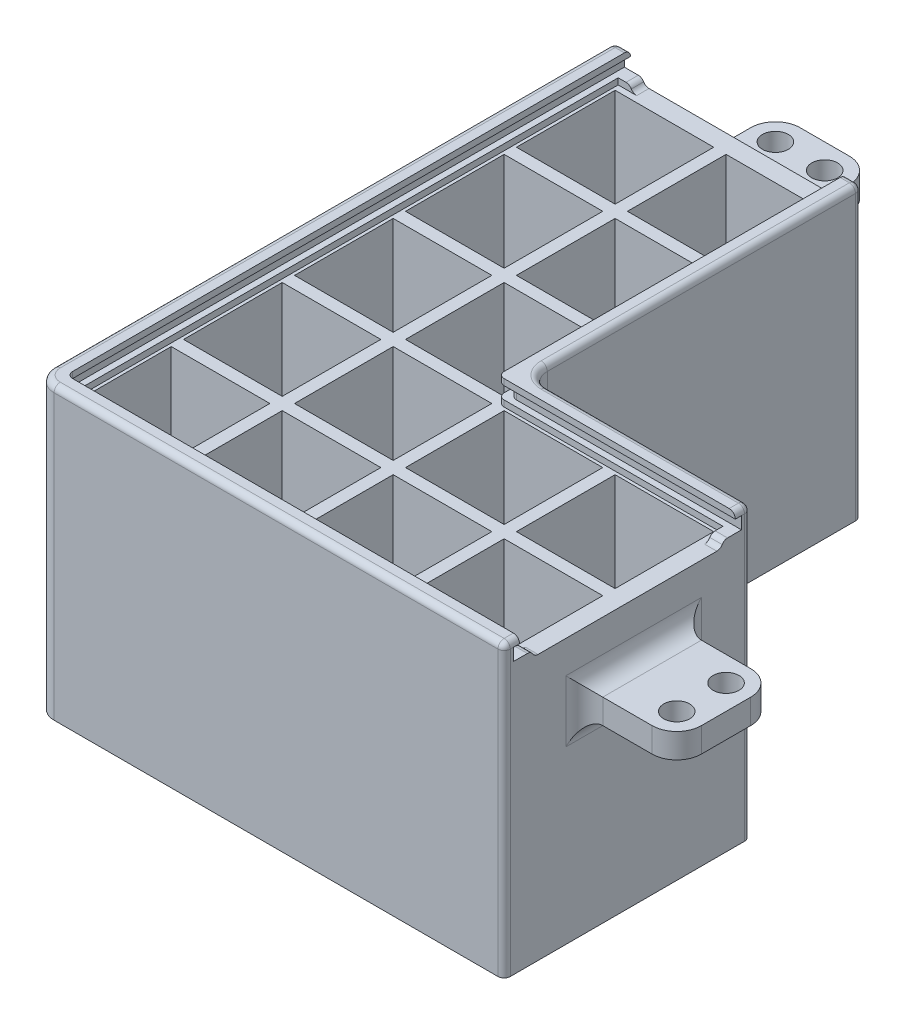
SolidWorks part; units mm, degrees
ref_plane "Front Plane" through (0, 0, 0) normal (0, 0, 1) x (1, 0, 0)
ref_plane "Top Plane" through (0, 0, 0) normal (0, 1, 0) x (1, 0, 0)
ref_plane "Right Plane" through (0, 0, 0) normal (1, 0, 0) x (0, 0, -1)
sketch "Sketch2" plane through (0, 0, 0) normal (0, 1, 0) x (1, 0, 0)
  line L0 (-37, 0) -> (-37, 37)
  line L1 (0, 0) -> (36, 0)
  line L3 (0, 40) -> (36, 40)
  line L4 (36, 0) -> (36, 40)
  line L5 (0, 0) -> (-40, 0)
  line L7 (0, 40) -> (-40, 40)
  line L8 (-40, 0) -> (-40, 40)
  line L9 (0, 0) -> (-40, 0)
  line L10 (0, 0) -> (0, -54)
  line L11 (0, -54) -> (-40, -54)
  line L12 (-40, 0) -> (-40, -54)
  line L13 (0, 37) -> (-37, 37)
  line L14 (0, 37) -> (33, 37)
  line L15 (33, 3) -> (33, 37)
  line L16 (0, 3) -> (33, 3)
  line L17 (-3, 0) -> (-3, -51)
  line L18 (-3, -51) -> (-37, -51)
  line L19 (-37, 0) -> (-37, -51)
  line L20 (17, 37) -> (17, 3)
  line L21 (15, 37) -> (15, 3)
  line L22 (-1, 37) -> (-1, 3)
  line L23 (-3, 37) -> (-3, 3)
  line L24 (-19, 37) -> (-19, 3)
  line L25 (-21, 37) -> (-21, 3)
  line L26 (-37, 37) -> (-37, 3)
  line L27 (0, 3) -> (-3, 3)
  line L28 (-39, 37) -> (-39, 3)
  line L29 (-3, 3) -> (-3, 0)
  line L30 (-19, 3) -> (-19, -51)
  line L31 (-21, 3) -> (-21, -51)
  line L32 (-37, 21) -> (33, 21)
  line L33 (-37, 19) -> (33, 19)
  line L34 (-37, 1) -> (33, 1)
  line L35 (-37, 3) -> (33, 3)
  line L36 (-37, -17) -> (-3, -17)
  line L37 (-37, -15) -> (-3, -15)
  line L38 (-37, -35) -> (-3, -35)
  line L39 (-37, -33) -> (-3, -33)
  line L41 (-37, -51) -> (-3, -51)
  line L44 (-37, -71) -> (33, -71)
  line L45 (-37, -53) -> (-3, -53)
  line L46 (-37, -69) -> (0, -69)
  dimension "D1" = 40
  dimension "D2" = 40
  dimension "D3" = 36
  dimension "D4" = 54
  dimension "D6" = 2
  dimension "D7" = 16
  dimension "D9" = 16
  dimension "D10" = 37
  dimension "D11" = 16
  dimension "D12" = 16
  dimension "D13" = 2
  dimension "D14" = 16
  dimension "D15" = 16
  dimension "D17" = 16
  dimension "D5" = 3
  dimension "D8" = 4
  dimension "D16" = 6
extrude "Boss-Extrude1" add sketch "Sketch2" along normal blind 40
sketch "Sketch3" plane through (0, 0, 0) normal (0, -1, 0) x (1, 0, 0)
  line L6 (0, 0) -> (0, 54)
  line L7 (0, 54) -> (-40, 54)
  line L8 (-40, 54) -> (-40, -40)
  line L9 (-40, -40) -> (36, -40)
  line L10 (36, -40) -> (36, 0)
  line L11 (36, 0) -> (0, 0)
  line L12 (0, 0) -> (0, 54)
  line L13 (0, 54) -> (-40, 54)
  line L14 (-40, 54) -> (-40, -40)
  line L15 (-40, -40) -> (36, -40)
  line L16 (36, -40) -> (36, 0)
  line L17 (36, 0) -> (0, 0)
  dimension "D1" = 0
extrude "Boss-Extrude2" add sketch "Sketch3" along normal blind 3
sketch "Sketch4" plane through (0, 40, 0) normal (0, 1, 0) x (1, 0, 0)
  line L0 (-2.5, -51.5) -> (-2.5, 2.5)
  line L1 (-2.5, 2.5) -> (33.5, 2.5)
  line L2 (33.5, 2.5) -> (33.5, 37.5)
  line L3 (33.5, 37.5) -> (-37.5, 37.5)
  line L4 (-37.5, 37.5) -> (-37.5, -51.5)
  line L5 (-37.5, -51.5) -> (-2.5, -51.5)
  line L6 (0, -54) -> (0, 0)
  line L7 (0, 0) -> (36, 0)
  line L8 (36, 0) -> (36, 40)
  line L9 (36, 40) -> (-40, 40)
  line L10 (-40, 40) -> (-40, -54)
  line L11 (-40, -54) -> (0, -54)
  line L12 (0, -54) -> (0, 0)
  line L13 (0, 0) -> (36, 0)
  line L14 (36, 0) -> (36, 40)
  line L15 (36, 40) -> (-40, 40)
  line L16 (-40, 40) -> (-40, -54)
  line L17 (-40, -54) -> (0, -54)
  line L18 (-37.5, -51.5) -> (-37.5, -54)
  line L19 (-2.5, -51.5) -> (-2.5, -54)
  line L20 (33.5, 2.5) -> (36, 2.5)
  line L21 (33.5, 37.5) -> (36, 37.5)
  dimension "D1" = 0
  dimension "D2" = 2.5
extrude "Boss-Extrude3" add sketch "Sketch4" along normal blind 4 contours L20 L1 L0 L19 L17 L12 L13 L14 | L3 L21 L14 L15 L16 L17 L18 L4
sketch "Sketch5" plane through (36, 0, 0) normal (1, 0, 0) x (0, 0, -1)
  line L0 (2.5, 44) -> (2.5, 40) construction
  line L1 (2.5, 43) -> (1.5, 43)
  line L2 (2.5, 43) -> (2.5, 41)
  line L3 (2.5, 41) -> (1.5, 41)
  line L4 (1.5, 43) -> (1.5, 41)
  line L5 (0, 44) -> (2.5, 44) construction
  line L6 (37.5, 44) -> (37.5, 40) construction
  line L7 (37.5, 43) -> (38.5, 43)
  line L8 (37.5, 43) -> (37.5, 41)
  line L9 (37.5, 41) -> (38.5, 41)
  line L10 (38.5, 43) -> (38.5, 41)
  line L11 (37.5, 44) -> (40, 44) construction
  dimension "D1" = 2
  dimension "D2" = 1
  dimension "D3" = 1
  dimension "D4" = 2
  dimension "D5" = 1
  dimension "D6" = 1
extrude "Cut-Extrude1" cut sketch "Sketch5" against normal offset from surface (74.5 mm away) 1.5 contours L2 L1 L4 L3 | L8 L7 L10 L9
sketch "Sketch6" plane through (0, 0, 54) normal (0, 0, 1) x (1, 0, 0)
  line L0 (-37.5, 44) -> (-37.5, 40) construction
  line L1 (-37.5, 43) -> (-38.5, 43)
  line L2 (-37.5, 43) -> (-37.5, 41)
  line L3 (-37.5, 41) -> (-38.5, 41)
  line L4 (-38.5, 43) -> (-38.5, 41)
  line L5 (-2.5, 44) -> (-2.5, 40) construction
  line L6 (-2.5, 43) -> (-1.5, 43)
  line L7 (-2.5, 43) -> (-2.5, 41)
  line L8 (-2.5, 41) -> (-1.5, 41)
  line L9 (-1.5, 43) -> (-1.5, 41)
  line L10 (-40, 44) -> (-37.5, 44) construction
  line L11 (-2.5, 44) -> (0, 44) construction
  dimension "D1" = 2
  dimension "D2" = 2
  dimension "D3" = 1
  dimension "D4" = 1
  dimension "D5" = 1
  dimension "D6" = 1
extrude "Cut-Extrude2" cut sketch "Sketch6" against normal offset from surface (92.5 mm away) 1.5
sketch "Sketch8" plane through (0, 40, 0) normal (0, 1, 0) x (1, 0, 0)
  line L1 (-37.5, -54) -> (-35.5, -54)
  line L2 (-37.5, -54) -> (-37.5, -52)
  line L3 (-37.5, -52) -> (-35.5, -52)
  line L4 (-35.5, -54) -> (-35.5, -52)
  line L5 (-2.5, -54) -> (-4.5, -54)
  line L6 (-2.5, -54) -> (-2.5, -52)
  line L7 (-2.5, -52) -> (-4.5, -52)
  line L8 (-4.5, -54) -> (-4.5, -52)
  line L9 (36, 2.5) -> (34, 2.5)
  line L10 (36, 2.5) -> (36, 4.5)
  line L11 (36, 4.5) -> (34, 4.5)
  line L12 (34, 2.5) -> (34, 4.5)
  line L13 (36, 37.5) -> (34, 37.5)
  line L14 (36, 37.5) -> (36, 35.5)
  line L15 (36, 35.5) -> (34, 35.5)
  line L16 (34, 37.5) -> (34, 35.5)
  dimension "D1" = 2
  dimension "D2" = 2
  dimension "D3" = 2
  dimension "D4" = 2
  dimension "D5" = 2
  dimension "D6" = 2
  dimension "D7" = 2
  dimension "D8" = 2
extrude "Boss-Extrude4" add sketch "Sketch8" along normal up to surface (1 mm away)
fillet "Fillet1" radius 3 2 edges at (-40, 20.5, -40) (0, 20.5, 0)
fillet "Fillet2" radius 1 16 edges at (-0.5, 44, -40) (-39.1213, 44, -39.1213) (19.5, 44, 0) (0.8787, 44, 0.8787) (36, 44, -38.75) (36, 20.5, -40) (36, 44, -1.25) (36, 20.5, 0) (-1.25, 44, 54) (0, 20.5, 54) (-38.75, 44, 54) (-40, 20.5, 54) (-40, 44, 8.5) (0, 44, 28.5) (-2.5, 43.5, -2.5) (-37.5, 43.5, -37.5)
fillet "Fillet3" radius 1 4 edges at (35, 40, -4.5) (35, 40, -35.5) (-35.5, 40, 53) (-4.5, 40, 53)
fillet "Fillet4" radius 1 4 edges at (35, 41, -35.5) (35, 41, -4.5) (-4.5, 41, 53) (-35.5, 41, 53)
sketch "Sketch10" plane through (0, 0, 54) normal (0, 0, 1) x (1, 0, 0)
  line L0 (-5.5, 40) -> (-34.5, 40) construction
  line L1 (-29, 31.75) -> (-13, 31.75)
  line L2 (-29, 31.75) -> (-29, 27.75)
  line L3 (-29, 27.75) -> (-13, 27.75)
  line L4 (-13, 31.75) -> (-13, 27.75)
  line L5 (-39, 43) -> (-39, -3) construction
  dimension "D1" = 4
  dimension "D2" = 16
  dimension "D3" = 8.25
  dimension "D4" = 10
extrude "Boss-Extrude5" add sketch "Sketch10" along normal blind 15
sketch "Sketch11" plane through (0, 31.75, 0) normal (0, 1, 0) x (1, 0, 0)
  line L0 (-13, -69) -> (-29, -69) construction
  line L1 (-29, -69) -> (-29, -54) construction
  circle A0 centre (-25, -65) radius 2.1
  circle A1 centre (-17, -65) radius 2.1
  dimension "D1" = 4.2
  dimension "D2" = 4.2
  dimension "D3" = 8
  dimension "D4" = 4
  dimension "D5" = 4
  dimension "D6" = 4
extrude "Cut-Extrude3" cut sketch "Sketch11" against normal through all
sketch "Sketch12" plane through (36, 0, 0) normal (1, 0, 0) x (0, 0, -1)
  line L0 (5.5, 40) -> (34.5, 40) construction
  line L1 (11, 31.75) -> (27, 31.75)
  line L2 (11, 31.75) -> (11, 27.75)
  line L3 (11, 27.75) -> (27, 27.75)
  line L4 (27, 31.75) -> (27, 27.75)
  line L5 (1, 43) -> (1, -3) construction
  dimension "D1" = 16
  dimension "D2" = 4
  dimension "D3" = 8.25
  dimension "D4" = 10
extrude "Boss-Extrude6" add sketch "Sketch12" along normal blind 15
sketch "Sketch13" plane through (0, 31.75, 0) normal (0, 1, 0) x (1, 0, 0)
  line L0 (51, 27) -> (51, 11) construction
  line L1 (51, 27) -> (36, 27) construction
  circle A0 centre (47, 15) radius 2.1
  circle A1 centre (47, 23) radius 2.1
  dimension "D3" = 4.2
  dimension "D4" = 4.2
  dimension "D1" = 4
  dimension "D2" = 4
  dimension "D5" = 8
  dimension "D6" = 4
extrude "Cut-Extrude4" cut sketch "Sketch13" against normal through all
fillet "Fillet5" radius 3 8 edges at (36, 31.75, -19) (36, 29.75, -27) (36, 29.75, -11) (36, 27.75, -19) (-29, 29.75, 54) (-21, 27.75, 54) (-13, 29.75, 54) (-21, 31.75, 54)
fillet "Fillet6" radius 4 4 edges at (51, 29.75, -27) (51, 29.75, -11) (-29, 29.75, 69) (-13, 29.75, 69)
fillet "Fillet7" radius 1 3 edges at (-37.5, 40.5, -37.5) (-1.5, 42, -1.5) (-2.5, 40.5, -2.5)
ref_plane "Plane1" through (0, 0, -50) normal (0, 0, -1) x (-1, 0, 0)
mirror "Mirror3" about plane through (0, 0, -50) normal (0, 0, -1)
delete or keep bodies "Body-Delete/Keep 1" type delete bodies bodies 110
